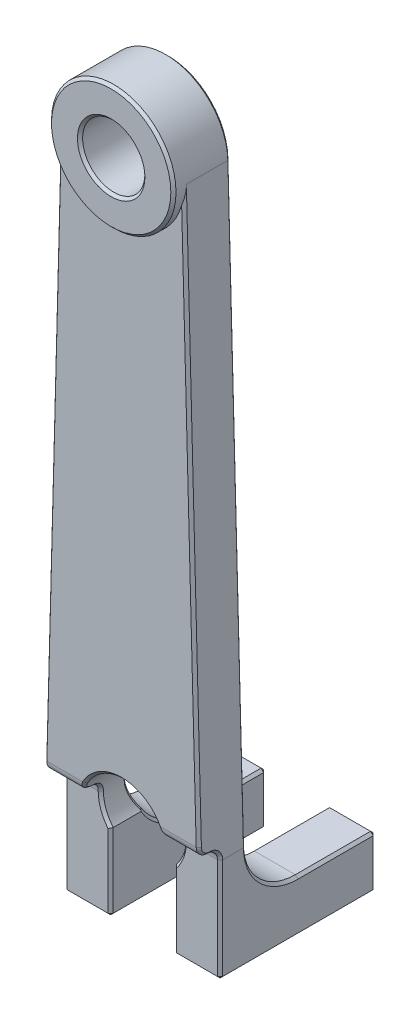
SolidWorks part; units mm, degrees
ref_plane "Спереди" through (0, 0, 0) normal (0, 0, 1) x (1, 0, 0)
ref_plane "Сверху" through (0, 0, 0) normal (0, 1, 0) x (1, 0, 0)
ref_plane "Справа" through (0, 0, 0) normal (1, 0, 0) x (0, 0, -1)
sketch "Эскиз1" plane through (0, 0, 0) normal (0, 0, 1) x (1, 0, 0)
  line L0 (0, 0) -> (0, 60.0987) construction
  line L1 (-3.05, -2.588) -> (-3.05, -10)
  line L2 (3.05, -2.588) -> (3.05, -10)
  line L3 (-7.5006, 0) -> (-5.9979, 56.6292)
  line L4 (7.5006, 0) -> (5.9979, 56.6292)
  line L5 (-7.5006, -10) -> (-3.05, -10)
  line L6 (-7.5006, 0) -> (7.5006, 0) construction
  line L7 (-7.5006, 0) -> (-7.5006, -10)
  line L8 (7.5006, 0) -> (7.5006, -10)
  line L9 (3.05, -10) -> (7.5006, -10)
  arc A0 (3.05, -2.588) -> (-3.05, -2.588) centre (0, 0) ccw
  circle A1 centre (0, 56.47) radius 3
  arc A2 (5.9979, 56.6292) -> (-5.9979, 56.6292) centre (0, 56.47) ccw
  dimension "D1" = 8
  dimension "D3" = 6
  dimension "D4" = 12
  dimension "D2" = 6.1
  dimension "D5" = 56.47
  dimension "D6" = 3.04
  dimension "D7" = 10
  dimension "D8" = 1.52
  dimension "D9" = 3.05
extrude "Бобышка-Вытянуть1" add sketch "Эскиз1" along normal blind 17
sketch "Эскиз2" plane through (0, 0, 0) normal (1, 0, 0) x (0, 0, -1)
  line L0 (-12.5, 62.47) -> (-12.5, 0)
  line L1 (0, 62.47) -> (-17, 62.47) construction
  line L2 (-7.5, -5) -> (0, -5)
  line L3 (0, -10) -> (0, 0) construction
  line L4 (-17, -10) -> (0, -10) construction
  line L5 (-17, 0) -> (-17, 56.6292) construction
  line L7 (-15, 0) -> (-15, -10)
  line L8 (-17, -10) -> (-17, 0) construction
  line L9 (-12.5, 62.47) -> (0, 62.47)
  line L10 (0, 56.6292) -> (0, 62.47) construction
  line L11 (0, 62.47) -> (0, -5)
  line L12 (-15, -10) -> (-17, -10)
  line L13 (-17, -10) -> (-19.6121, -10)
  line L14 (-19.6121, -10) -> (-19.6121, 5.0204)
  line L15 (-19.6121, 5.0204) -> (-17, 5.0204)
  line L16 (-17, 5.0204) -> (-17, 2)
  arc A0 (-16, 1) -> (-17, 2) centre (-16, 2) cw
  arc A1 (-15, 0) -> (-16, 1) centre (-16, 0) ccw
  arc A2 (-12.5, 0) -> (-7.5, -5) centre (-7.5, 0) ccw
  point P26 (-17, 1)
  dimension "D5" = 1
  dimension "D6" = 5
  dimension "D1" = 5
  dimension "D2" = 4.5
  dimension "D3" = 2
  dimension "D4" = 10
extrude "Вырез-Вытянуть1" cut sketch "Эскиз2" against normal mid plane 25
sketch "Эскиз3" plane through (0, 0, 17) normal (0, 0, 1) x (1, 0, 0)
  circle A0 centre (0, 56.47) radius 3 construction
  circle A1 centre (0, 56.47) radius 3
  circle A2 centre (0, 56.47) radius 6
  arc A3 (5.9979, 56.6292) -> (-5.9979, 56.6292) centre (0, 56.47) ccw construction
extrude "Бобышка-Вытянуть2" add sketch "Эскиз3" along normal blind 1
chamfer "Фаска1" distance 0.25 angle 45 48 edges at (3, 56.47, 18) (0, 53.47, 12.5) (6, 56.47, 18) (-7.4818, 0.7071, 15.2929) (-7.4662, 1.2929, 16.7071) (-6.7227, 29.3146, 17) (7.4818, 0.7071, 15.2929) (7.4662, 1.2929, 16.7071) (6.7227, 29.3146, 17) (-6.7492, 28.3146, 12.5) (0, 62.47, 12.5) (6.7492, 28.3146, 12.5) (7.5006, -3.5355, 11.0355) (7.5006, -5, 15) (5.2753, -10, 15) (7.5006, -10, 7.5) (5.2753, -10, 0) (7.5006, -7.5, 0) (7.5006, -5, 3.75) (5.2753, -5, 0) (3.05, -7.5, 0) (3.05, -10, 7.5) (3.05, -6.294, 15) (3.755, -1.3784, 15) (-3.9334, 0.7271, 15.3134) (3.9686, 0.4998, 15.1339) (-3.7666, 1.3463, 16.7568) (3.8144, 1.2042, 16.6055) (0, 4, 17) (-7.5006, -3.5355, 11.0355) (-7.5006, -5, 15) (-5.2753, -10, 15) (-7.5006, -10, 7.5) (-7.5006, -7.5, 0) (-5.2753, -10, 0) (-7.5006, -5, 3.75) (-5.2753, -5, 0) (-3.755, -1.3784, 15) (-3.05, -6.294, 15) (-3.05, -10, 7.5) (-3.05, -7.5, 0) (-3.05, -5, 3.75) (-3.05, -4.3554, 9.9556) (3.05, -5, 3.75) (3.05, -4.3554, 9.9556) (-3.683, -1.5607, 12.2502) (3.6802, -1.5671, 12.2481) (0, 4, 12.5)
